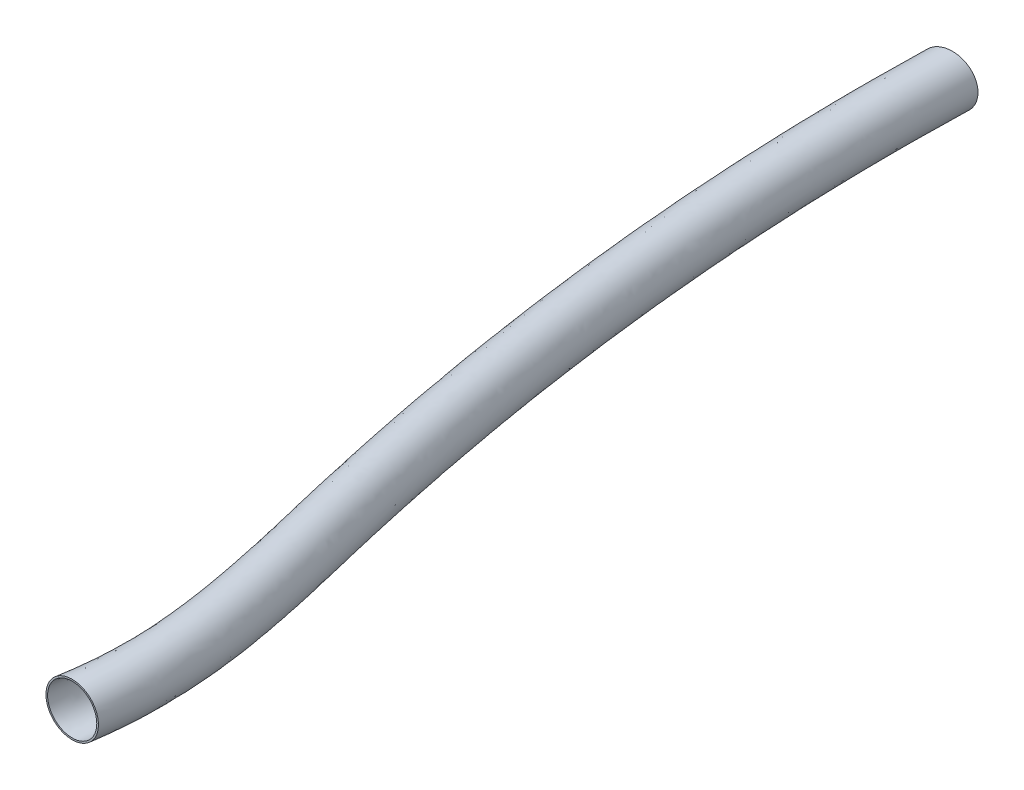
SolidWorks part; units mm, degrees
ref_plane "前基準面" through (0, 0, 0) normal (0, 0, 1) x (1, 0, 0)
ref_plane "上基準面" through (0, 0, 0) normal (0, 1, 0) x (1, 0, 0)
ref_plane "右基準面" through (0, 0, 0) normal (1, 0, 0) x (0, 0, -1)
sketch "草圖1" plane through (0, 0, 0) normal (0, 0, 1) x (1, 0, 0)
  circle A0 centre (0, 0) radius 16
  circle A1 centre (0, 0) radius 15
  dimension "D1" = 32
  dimension "D2" = 30
ref_plane "平面1" through (0, 10, 0) normal (0, 1, 0) x (-1, 0, 0)
sketch "草圖3" plane through (0, 10, 0) normal (0, 1, 0) x (-1, 0, 0)
  spline S0 degree 3 poles (0, 0) (-10.5088, -62.7091) (44.4511, -258.5193) (69.6143, -458.9613) (65.5683, -600) knots 0 0 0 0 0.305137 1 1 1 1
  dimension "D1" = 600
sweep "掃出3" add profiles "草圖1" path "草圖3"
